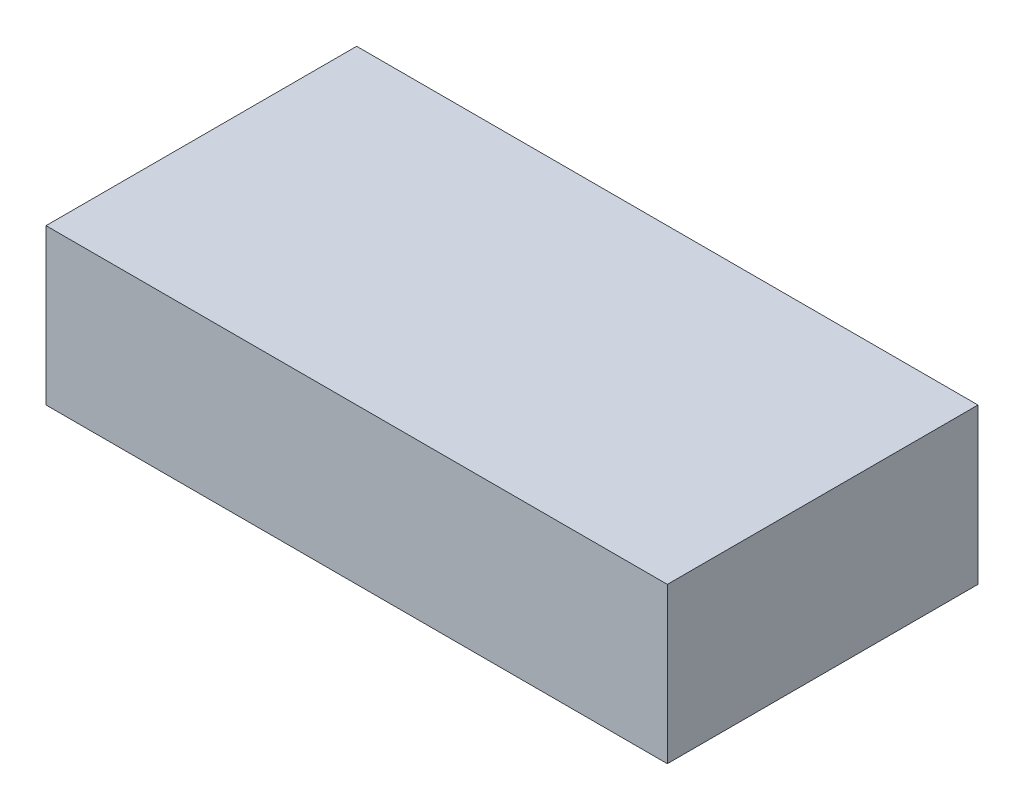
SolidWorks part; units mm, degrees
ref_plane "Front Plane" through (0, 0, 0) normal (0, 0, 1) x (1, 0, 0)
ref_plane "Top Plane" through (0, 0, 0) normal (0, 1, 0) x (1, 0, 0)
ref_plane "Right Plane" through (0, 0, 0) normal (1, 0, 0) x (0, 0, -1)
sketch "Sketch1" plane through (0, 0, 0) normal (0, 0, 1) x (1, 0, 0)
  line L1 (19.05, -4.7625) -> (-19.05, -4.7625)
  line L2 (19.05, -4.7625) -> (19.05, 4.7625)
  line L3 (19.05, 4.7625) -> (-19.05, 4.7625)
  line L4 (-19.05, -4.7625) -> (-19.05, 4.7625)
  line L5 (19.05, -4.7625) -> (-19.05, 4.7625) construction
  line L6 (19.05, 4.7625) -> (-19.05, -4.7625) construction
  point P0 (0, 0)
  dimension "D1" = 38.1
  dimension "D2" = 9.525
extrude "Boss-Extrude1" add sketch "Sketch1" along normal blind 19.05
